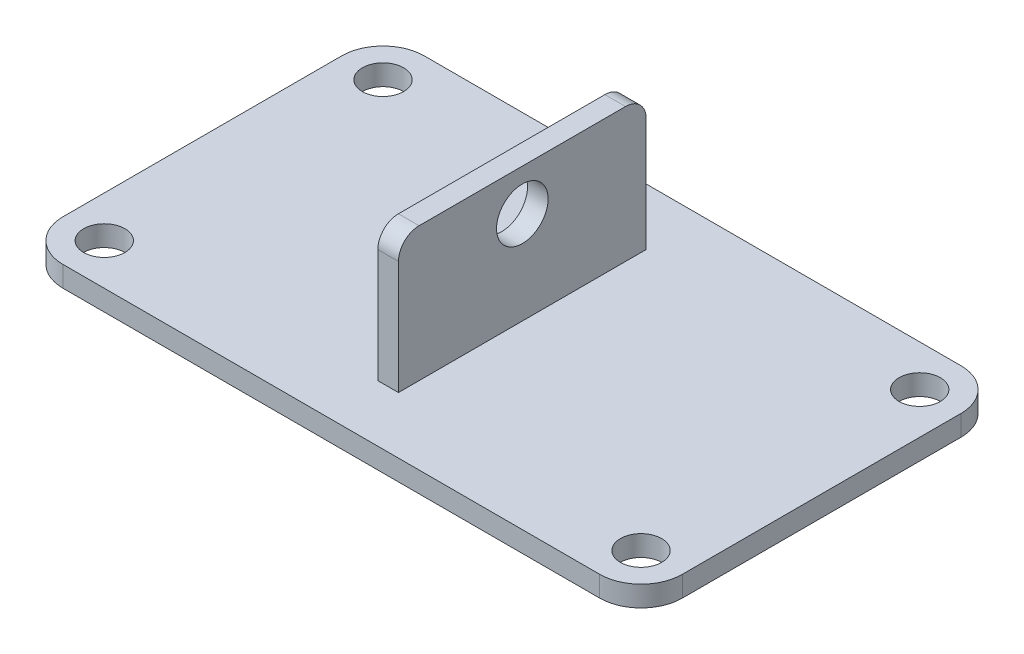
SolidWorks part; units mm, degrees
ref_plane "Front Plane" through (0, 0, 0) normal (0, 0, 1) x (1, 0, 0)
ref_plane "Top Plane" through (0, 0, 0) normal (0, 1, 0) x (1, 0, 0)
ref_plane "Right Plane" through (0, 0, 0) normal (1, 0, 0) x (0, 0, -1)
sketch "Sketch1" plane through (0, 0, 0) normal (0, 1, 0) x (1, 0, 0)
  line L0 (0, 129.3202) -> (0, -119.9226) construction
  line L1 (-130, -87.5) -> (130, -87.5)
  line L2 (-150, -67.5) -> (-150, 67.5)
  line L3 (-130, 87.5) -> (130, 87.5)
  line L4 (150, -67.5) -> (150, 67.5)
  line L5 (-150, -87.5) -> (150, 87.5) construction
  line L6 (-150, 87.5) -> (150, -87.5) construction
  line L7 (185.4552, 0) -> (-174.1904, 0) construction
  arc A0 (150, 67.5) -> (130, 87.5) centre (130, 67.5) ccw
  circle A1 centre (130, 67.5) radius 10
  arc A2 (-130, 87.5) -> (-150, 67.5) centre (-130, 67.5) ccw
  arc A3 (-150, -67.5) -> (-130, -87.5) centre (-130, -67.5) ccw
  arc A4 (130, -87.5) -> (150, -67.5) centre (130, -67.5) ccw
  circle A5 centre (130, -67.5) radius 10
  circle A6 centre (-130, 67.5) radius 10
  circle A7 centre (-130, -67.5) radius 10
  point P0 (0, 0)
  dimension "D3" = 20
  dimension "D4" = 20
  dimension "D5" = 20
  dimension "D6" = 20
  dimension "D7" = 20
  dimension "D8" = 20
  dimension "D1" = 300
  dimension "D2" = 175
extrude "Boss-Extrude1" add sketch "Sketch1" along normal blind 10
sketch "Sketch2" plane through (0, 0, 0) normal (1, 0, 0) x (0, 0, -1)
  line L0 (-67.5, 10) -> (67.5, 10) construction
  line L1 (-60, 10) -> (60, 10)
  line L2 (-60, 10) -> (-60, 65)
  line L3 (-50, 75) -> (50, 75)
  line L4 (60, 10) -> (60, 65)
  line L5 (87.5, 10) -> (87.5, 0) construction
  line L6 (-87.5, 10) -> (-87.5, 0) construction
  line L7 (-67.5, 0) -> (67.5, 0) construction
  arc A0 (60, 65) -> (50, 75) centre (50, 65) ccw
  arc A1 (-60, 65) -> (-50, 75) centre (-50, 65) cw
  circle A2 centre (0, 55) radius 12.5
  point P12 (60, 75)
  point P15 (-60, 75)
  dimension "D4" = 10
  dimension "D5" = 25
  dimension "D1" = 120
  dimension "D2" = 27.5
  dimension "D3" = 27.5
  dimension "D6" = 75
  dimension "D7" = 55
extrude "Boss-Extrude3" add sketch "Sketch2" along normal mid plane 10
